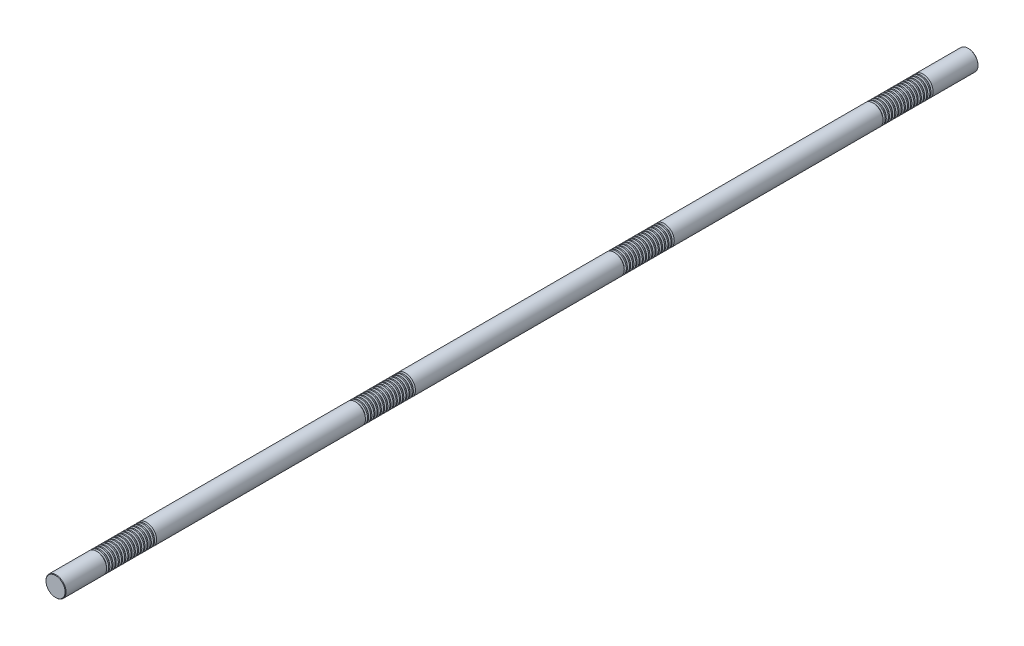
SolidWorks part; units mm, degrees
ref_plane "Front Plane" through (0, 0, 0) normal (0, 0, 1) x (1, 0, 0)
ref_plane "Top Plane" through (0, 0, 0) normal (0, 1, 0) x (1, 0, 0)
ref_plane "Right Plane" through (0, 0, 0) normal (1, 0, 0) x (0, 0, -1)
sketch "Sketch1" plane through (0, 0, 0) normal (0, 0, 1) x (1, 0, 0)
  circle A0 centre (0, 0) radius 22
  dimension "D1" = 44
extrude "Boss-Extrude1" add sketch "Sketch1" along normal mid plane 2000
chamfer "Chamfer1" distance 1.1 angle 45 2 edges at (22, 0, -1000) (22, 0, 1000)
sketch "Sketch2" plane through (0, 0, 0) normal (1, 0, 0) x (0, 0, -1)
  line L0 (900.5359, 22) -> (895.9641, 22)
  line L1 (998.9, 22) -> (-998.9, 22) construction
  line L2 (895.9641, 22) -> (897.0359, 18)
  line L3 (897.0359, 18) -> (899.4641, 18)
  line L4 (899.4641, 18) -> (900.5359, 22)
  line L5 (1000, -20.9) -> (1000, 20.9) construction
  point P4 (898.25, 22)
  point P7 (898.25, 18)
  point P8 (900, 20)
  point P9 (896.5, 20)
  dimension "D1" = 3.5
  dimension "D2" = 100
  dimension "D3" = 4
  dimension "D4" = 30
revolve "Cut-Revolve1" cut sketch "Sketch2" angle 360 about axis through (0, 0, 1000) along (0, 0, -1)
pattern_linear "LPattern1" count 16 spacing 7 along (0, 0, 1) of "Cut-Revolve1"
pattern_linear "LPattern2" count 4 spacing 567 along (0, 0, 1) of "Cut-Revolve1", "LPattern1"
